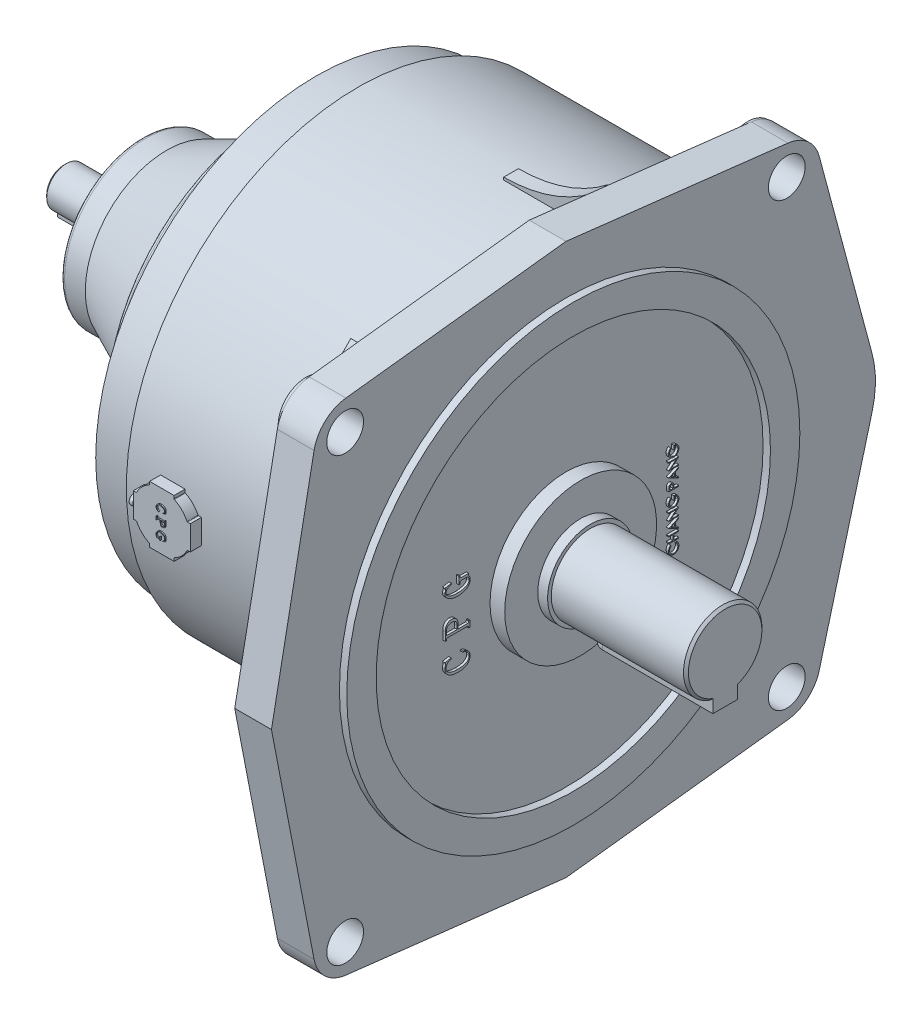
SolidWorks part; units mm, degrees
ref_plane "前视基准面" through (0, 0, 0) normal (0, 0, 1) x (1, 0, 0)
ref_plane "上视基准面" through (0, 0, 0) normal (0, 1, 0) x (1, 0, 0)
ref_plane "右视基准面" through (0, 0, 0) normal (1, 0, 0) x (0, 0, -1)
sketch "草图1" plane through (0, 0, 0) normal (0, 1, 0) x (1, 0, 0)
  line L0 (0, 0) -> (15.7361, 0) construction
  line L1 (0, 0) -> (0, -16)
  line L2 (0, -16) -> (-55, -16)
  line L3 (-55, -16) -> (-55, -17.5)
  line L4 (-55, -17.5) -> (-59, -17.5)
  line L5 (-62, -31) -> (-62, -92.5)
  line L6 (-62, -92.5) -> (-65, -92.5)
  line L7 (-65, -92.5) -> (-65, 0)
  line L8 (-65, 0) -> (0, 0)
  line L9 (-62, -31) -> (-59, -31)
  line L10 (-59, -31) -> (-59, -17.5)
  dimension "D1" = 55
  dimension "D2" = 32
  dimension "D3" = 35
  dimension "D4" = 3
  dimension "D5" = 185
  dimension "D6" = 65
  dimension "D7" = 3
  dimension "D8" = 62
revolve "旋转1" add sketch "草图1" angle 360 about L0
sketch "草图2" plane through (0, 0, 0) normal (0, 1, 0) x (1, 0, 0)
  line L0 (8.0167, 30) -> (-80, 30) construction
  line L4 (-80, 30) -> (-80, -64.5)
  line L5 (-80, -64.5) -> (-180, -64.5)
  line L6 (-180, -64.5) -> (-180, 30)
  line L11 (-80, 30) -> (-180, 30)
  dimension "D1" = 30
  dimension "D3" = 189
  dimension "D5" = 100
revolve "旋转2" add sketch "草图2" angle 360 about L0
sketch "草图12" plane through (-80, 0, 0) normal (1, 0, 0) x (0, 0, -1)
  line L0 (0, -112.5) -> (100.7627, -100.7627)
  line L1 (-100.7627, -100.7627) -> (0, -112.5)
  line L2 (-100.7627, -100.7627) -> (-120.238, 0)
  line L3 (-100.7627, 100.7627) -> (0, 112.5)
  line L4 (100.7627, -100.7627) -> (127.762, 0)
  line L5 (-120.238, 0) -> (-100.7627, 100.7627)
  line L6 (0, 112.5) -> (100.7627, 100.7627)
  line L7 (127.762, 0) -> (100.7627, 100.7627)
  line L8 (167.8979, 0) -> (-107.2143, 0) construction
  line L9 (0, 107.5085) -> (0, -103.3164) construction
  line L10 (0, 0) -> (-90.1561, 90.1561) construction
  line L11 (0, 0) -> (90.1561, 90.1561) construction
  circle A0 centre (0, 0) radius 127.5 construction
  circle A1 centre (-90.1561, 90.1561) radius 7.5
  circle A2 centre (90.1561, 90.1561) radius 7.5
  circle A3 centre (90.1561, -90.1561) radius 7.5
  circle A4 centre (-90.1561, -90.1561) radius 7.5
  dimension "D3" = 225
  dimension "D4" = 15
  dimension "D5" = 15
  dimension "D1" = 225
  dimension "D2" = 248
  dimension "D6" = 15
extrude "拉伸8" add sketch "草图12" along normal up to surface (15 mm away)
sketch "草图5" plane through (0, 0, 0) normal (0, 1, 0) x (1, 0, 0)
  line L0 (0, -5) -> (-45, -5)
  line L1 (0, -16) -> (0, 16) construction
  line L2 (-45, 5) -> (0, 5)
  line L3 (0, 5) -> (0, -5)
  line L4 (35.5, -13.7955) -> (35.5, 19.6443) construction
  arc A0 (-45, -5) -> (-45, 5) centre (-45, 0) cw
  dimension "D2" = 50
  dimension "D1" = 10
  dimension "D3" = 35.5
extrude "拉伸4" add sketch "草图5" against normal blind 19.5
fillet "圆角4" radius 15 4 edges at (-72.5, 100.7627, 100.7627) (-72.5, 100.7627, -100.7627) (-72.5, -100.7627, -100.7627) (-72.5, -100.7627, 100.7627)
fillet "圆角5" radius 40 1 edges at (-72.5, 0, -127.762)
chamfer "倒角1" distance 1 angle 45 1 edges at (0, 16, 0)
sketch "草图18" plane through (-80, 0, 0) normal (-1, 0, 0) x (0, 0, 1)
  line L0 (-30, 0) -> (73.8927, -103.8927) construction
  line L1 (0, -99) -> (0, 99) construction
  line L2 (89.8548, -102.0333) -> (0, -112.5) construction
  line L3 (36.8216, -66.8216) -> (73.8927, -103.8927)
  line L4 (-30, 0) -> (-90.1561, -90.1561) construction
  line L5 (-88.91, -87.0419) -> (-82.4506, -78.6078)
  line L7 (-30, 0) -> (-30, -109.0055) construction
  line L8 (0, -112.5) -> (-90.6456, -101.9412) construction
  line L9 (-30, -94.5) -> (-30, -109.0055)
  circle A0 centre (-30, 0) radius 94.5 construction
  arc A1 (-103.3989, -90.9242) -> (-90.6456, -101.9412) centre (-88.91, -87.0419) ccw construction
  circle A3 centre (-30, 0) radius 94.5 construction
  dimension "D1" = 45
  dimension "D2" = 10.6235
  dimension "D4" = 52.4264
  dimension "D5" = 14.5055
ref_plane "基准面7" through (-81, 0, 0) normal (1, 0, 0) x (0, 0, -1)
sketch "草图13" plane through (-80, 0, 0) normal (1, 0, 0) x (0, 0, -1)
  line L5 (0, 0) -> (107.7406, 0) construction
  circle A1 centre (90.1561, 90.1561) radius 11.6458
  circle A3 centre (90.1561, 90.1561) radius 7.5
  circle A4 centre (90.1561, -90.1561) radius 7.5 construction
  circle A5 centre (90.1561, -90.1561) radius 7.5
  circle A7 centre (-90.1561, -90.1561) radius 7.5
  arc A10 (90.6456, -101.9412) -> (103.3989, -90.9242) centre (88.91, -87.0419) ccw construction
  circle A11 centre (-90.1561, -90.1561) radius 7.5 construction
  arc A12 (-102.8467, -89.9806) -> (-89.8548, -102.0333) centre (-88.1192, -87.1341) ccw construction
  circle A14 centre (-90.1561, 90.1561) radius 7.5
  circle A15 centre (-90.1561, 90.1561) radius 11.3556
  circle A20 centre (-90.1561, -90.1561) radius 11.3556
  circle A21 centre (90.1561, -90.1561) radius 11.6458
  point P8 (30, 0)
extrude "拉伸9" add sketch "草图13" against normal up to surface (1 mm away)
sketch "草图14" plane through (0, 0, 0) normal (0, 1, 0) x (1, 0, 0)
  line L0 (-80, 30) -> (-180, 30) construction
  line L5 (-80, -89.8548) -> (-80, 0) construction
  line L6 (-117.4264, -64.5) -> (-117.4264, -65.5)
  line L7 (-80, -101.9264) -> (-81, -101.9264)
  line L9 (-80, -64.5) -> (-180, -64.5) construction
  arc A0 (-81, -101.9264) -> (-117.4264, -65.5) centre (-117.4264, -101.9264) ccw
  dimension "D1" = 131.9264
  dimension "D2" = 1
  dimension "D3" = 1
rib "筋17" sketch "草图14" sketch "草图14" thickness 6 extrusion direction parallel to sketch draft on no parameters "D1"=6
pattern_circular "阵列(圆周)16" count 8 over 360 about axis through (0, 0, -30) along (1, 0, 0) of "筋17"
ref_plane "基准面8" through (0, 0, -30) normal (0, 0, 1) x (1, 0, 0)
sketch "草图17" plane through (0, 0, -30) normal (0, 0, 1) x (1, 0, 0)
  line L0 (-80, -108.0055) -> (-81, -108.0055)
  line L1 (-80, -102.0333) -> (-80, -112.5) construction
  line L2 (-117.4264, -94.5) -> (-117.4264, -95.5)
  line L4 (-180, -94.5) -> (-80, -94.5) construction
  line L6 (-117.4264, -69.65) -> (-117.4264, -65.4074) construction
  arc A0 (-81, -108.0055) -> (-117.4264, -95.5) centre (-117.4264, -154.8049) ccw
  dimension "D1" = 13.5055
  dimension "D2" = 1
  dimension "D3" = 1
rib "筋24" sketch "草图17" sketch "草图17" thickness 6 extrusion direction parallel to sketch draft on no parameters "D1"=6
mirror "镜向1" about plane through (0, 0, 0) normal (0, 1, 0) of "筋24"
sketch "草圖1" plane through (0, 0, 0) normal (0, 1, 0) x (1, 0, 0)
  line L0 (-269.0797, 30) -> (-111.2984, 30) construction
  line L1 (-197, 30) -> (-300, 30)
  line L2 (-197.5, 99.75) -> (-212, 99.75)
  line L5 (-213.5, 83.75) -> (-258, 63.25)
  line L6 (-271.5, 38) -> (-271.5, 37.95)
  line L9 (-266.5, 63.25) -> (-258, 63.25)
  line L10 (-213.5, 98.25) -> (-213.5, 83.75)
  line L11 (-271.5, 38) -> (-299, 38)
  line L12 (-270, 37.95) -> (-271.5, 37.95)
  line L13 (-269.5, 39.75) -> (-270, 39.45)
  line L14 (-300, 30) -> (-300, 37)
  line L15 (-300, 37) -> (-299, 38)
  line L16 (-268, 39.75) -> (-269.5, 39.75)
  line L18 (-197, 99.25) -> (-197, 30)
  line L19 (-270, 39.45) -> (-270, 37.95)
  line L20 (-268, 39.75) -> (-268, 61.75)
  arc A0 (-197, 99.25) -> (-197.5, 99.75) centre (-197.5, 99.25) ccw
  arc A1 (-197, 99.25) -> (-197.5, 99.75) centre (-197.5, 99.25) ccw
  arc A2 (-266.5, 63.25) -> (-268, 61.75) centre (-266.5, 61.75) ccw
  arc A3 (-212, 99.75) -> (-213.5, 98.25) centre (-212, 98.25) ccw
  dimension "D1" = 30
  dimension "D2" = 16
  dimension "D3" = 30
  dimension "D4" = 300
  dimension "D5" = 139.5
  dimension "D6" = 103
sketch "草圖2" plane through (-180, 0, 0) normal (-1, 0, 0) x (0, 0, 1)
  line L0 (-99.25, 0) -> (-30, 0) construction
  circle A0 centre (-30, 0) radius 90
  dimension "D1" = 180
extrude "伸長1" add sketch "草圖2" along normal blind 17
revolve "旋轉1" add sketch "草圖1" angle 360 about L0
ref_plane "平面1" through (0, 0, -30) normal (0, 0, 1) x (1, 0, 0)
sketch "草圖4" plane through (-62, 0, 0) normal (1, 0, 0) x (0, 0, -1)
  circle A0 centre (0, 0) radius 80.5
  circle A1 centre (0, 0) radius 31 construction
  circle A2 centre (0, 0) radius 31
  dimension "D1" = 161
extrude "伸長3" cut sketch "草圖4" against normal blind 3
sketch "草圖5"
  dimension "D1" = 80
  dimension "D2" = 80
  dimension "D3" = 40
  dimension "D4" = 45
  dimension "D5" = 40
extrude "伸長4" add sketch "草圖5" along normal blind 1
sketch "草圖6" plane through (0, 0, 0) normal (0, 1, 0) x (1, 0, 0)
  line L0 (-331.4772, 30) -> (-260.5755, 30) construction
  line L1 (-300, 27.5) -> (-275.5, 27.5)
  line L2 (-300, 37) -> (-300, 23) construction
  line L3 (-275.5, 32.5) -> (-300, 32.5)
  line L4 (-300, 32.5) -> (-300, 27.5)
  line L5 (-273, 30) -> (-273, 14.2392) construction
  line L6 (-318.2, 30) -> (-318.2, 16.5141) construction
  arc A0 (-275.5, 27.5) -> (-275.5, 32.5) centre (-275.5, 30) ccw
  dimension "D1" = 8
  dimension "D2" = 5
  dimension "D3" = 2.5
  dimension "D4" = 27
  dimension "D5" = 18.2
extrude "伸長5" add sketch "草圖6" against normal blind 10.2
ref_plane "平面2" through (0, 0, 69) normal (0, 0, 1) x (1, 0, 0)
sketch "草圖7" plane through (0, 0, 69) normal (0, 0, 1) x (1, 0, 0)
  line L0 (-166, 11.65) -> (-156, 11.65)
  line L1 (-166, 11.65) -> (-166, 10.5119)
  line L2 (-156, 11.65) -> (-156, 10.5119)
  line L3 (-166, -10.5119) -> (-166, -11.65)
  line L4 (-156, -10.5119) -> (-156, -11.65)
  line L5 (-172.65, 5) -> (-171.5119, 5)
  line L6 (-172.65, -5) -> (-171.5119, -5)
  line L7 (-172.65, -5) -> (-172.65, 5)
  line L8 (-166, -11.65) -> (-166, -10.5119)
  line L9 (-156, -11.65) -> (-156, -10.5119)
  line L10 (-156, -11.65) -> (-166, -11.65)
  line L11 (-149.35, -5) -> (-150.4881, -5)
  line L12 (-149.35, 5) -> (-150.4881, 5)
  line L13 (-149.35, 5) -> (-149.35, -5)
  arc A0 (-166.1383, 10.2882) -> (-171.2882, 5.1383) centre (-161, 0) ccw
  arc A1 (-166.1383, 10.2882) -> (-166, 10.5119) centre (-166.25, 10.5119) ccw
  arc A2 (-156, 10.5119) -> (-155.8617, 10.2882) centre (-155.75, 10.5119) ccw
  arc A3 (-171.5119, 5) -> (-171.2882, 5.1383) centre (-171.5119, 5.25) ccw
  arc A4 (-171.2882, -5.1383) -> (-171.5119, -5) centre (-171.5119, -5.25) ccw
  arc A5 (-166, -10.5119) -> (-166.1383, -10.2882) centre (-166.25, -10.5119) ccw
  arc A6 (-155.8617, -10.2882) -> (-156, -10.5119) centre (-155.75, -10.5119) ccw
  arc A7 (-150.4881, -5) -> (-150.7118, -5.1383) centre (-150.4881, -5.25) ccw
  arc A8 (-150.7118, 5.1383) -> (-150.4881, 5) centre (-150.4881, 5.25) ccw
  arc A9 (-150.7118, 5.1383) -> (-155.8617, 10.2882) centre (-161, 0) ccw
  arc A10 (-171.2882, -5.1383) -> (-166.1383, -10.2882) centre (-161, 0) ccw
  arc A11 (-155.8617, -10.2882) -> (-150.7118, -5.1383) centre (-161, 0) ccw
extrude "伸長6" add sketch "草圖7" against normal blind 4.5 separate body contours A6 A11 A7 L11 L13 L12 A8 A9 A2 L2 L0 L1 A1 A0 A3 L5 L7 L6 A4 A10 A5 L3 L10 L4
sketch "草圖8"
extrude "伸長7" add sketch "草圖8" along normal blind 0.5
sketch "草圖9" plane through (0, 0, 0) normal (0, 1, 0) x (1, 0, 0)
  line L0 (-174.6144, -66.75) -> (-166.6144, -66.75)
  line L1 (-174.6144, -66.75) -> (-174.6144, -64.75)
  line L2 (-173.1144, -65.5) -> (-173.1144, -64.75)
  line L13 (-171.1144, -65.5) -> (-166.6144, -65.75)
  line L15 (-173.1144, -65.5) -> (-171.1144, -65.5)
  line L23 (-174.6144, -64.75) -> (-173.1144, -64.75)
  line L24 (-171.1144, -66.75) -> (-171.1144, -65.5)
  line L25 (-166.6144, -66.75) -> (-166.6144, -65.75)
revolve "旋轉2" add sketch "草圖9" angle 360 about L0
equation "\"D5@草图1\" = \"D1@草圖4\"+24"
equation "\"D3@草图1\" = \"D2@草图1\"+3"
equation "\"D1@拉伸4\" = \"D3@草图5\"-\"D2@草图1\"/2"
equation "\"D1@伸長5\" = \"D5@草圖6\"-\"D2@草圖1\"/2"
